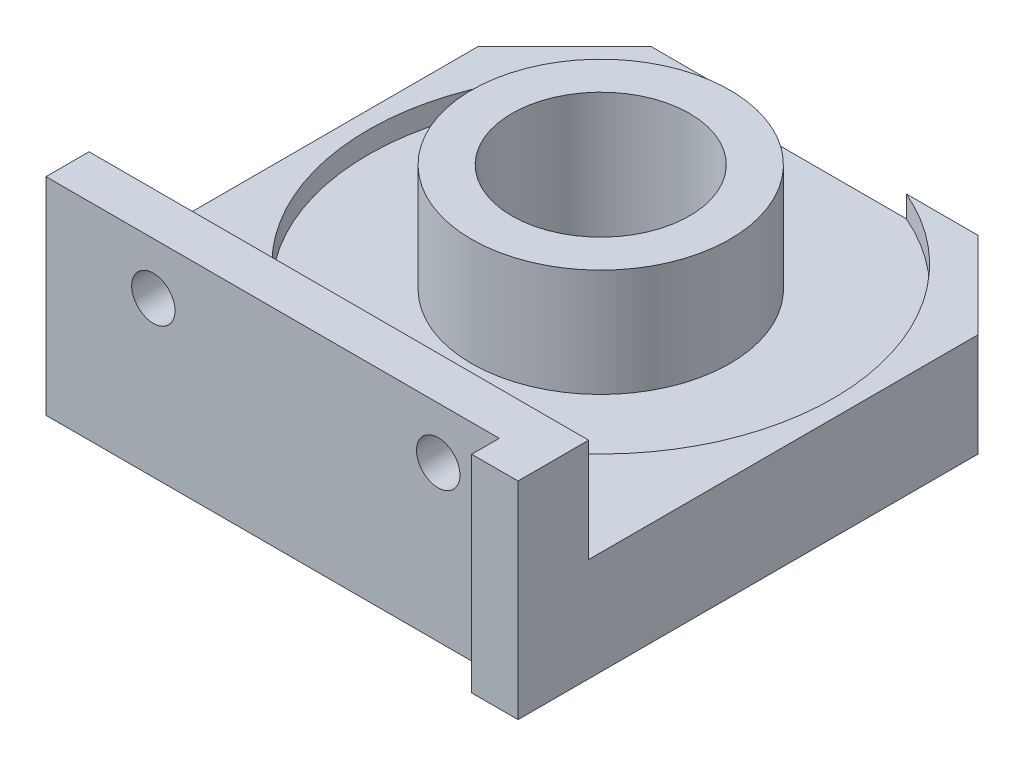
SolidWorks part; units mm, degrees
ref_plane "Front Plane" through (0, 0, 0) normal (0, 0, 1) x (1, 0, 0)
ref_plane "Top Plane" through (0, 0, 0) normal (0, 1, 0) x (1, 0, 0)
ref_plane "Right Plane" through (0, 0, 0) normal (1, 0, 0) x (0, 0, -1)
sketch "Sketch1" plane through (0, 0, 0) normal (0, 1, 0) x (1, 0, 0)
  line L1 (0, 0) -> (-36.83, 0)
  line L2 (0, 0) -> (0, 38.227)
  line L3 (0, 38.227) -> (-36.83, 38.227)
  line L4 (-36.83, 0) -> (-36.83, 38.227)
  dimension "D1" = 38.227
  dimension "D2" = 36.83
extrude "Boss-Extrude1" add sketch "Sketch1" against normal blind 7.62
sketch "Sketch2" plane through (0, 0, 0) normal (0, 1, 0) x (1, 0, 0)
  line L0 (-36.83, 38.227) -> (-36.83, 0) construction
  line L1 (0, 0) -> (-36.83, 0)
  line L2 (0, 0) -> (0, 3.175)
  line L3 (0, 3.175) -> (-36.83, 3.175)
  line L4 (-36.83, 0) -> (-36.83, 3.175)
  dimension "D1" = 3.175
extrude "Boss-Extrude2" add sketch "Sketch2" along normal blind 7.62
sketch "Sketch3" plane through (0, 0, 0) normal (0, 0, 1) x (1, 0, 0)
  line L0 (-36.83, -7.62) -> (0, -7.62) construction
  line L1 (0, 7.62) -> (-3.415, 7.62)
  line L2 (0, 7.62) -> (0, -7.62)
  line L3 (0, -7.62) -> (-3.415, -7.62)
  line L4 (-3.415, 7.62) -> (-3.415, -7.62)
  dimension "D1" = 3.415
extrude "Boss-Extrude3" add sketch "Sketch3" along normal blind 2.032
sketch "Sketch4" plane through (0, 0, 0) normal (0, 1, 0) x (1, 0, 0)
  line L0 (-36.83, 0) -> (-3.415, 0) construction
  line L1 (-36.83, 22.48) -> (0, 22.48) construction
  line L2 (-36.83, 38.227) -> (-36.83, 3.175) construction
  line L3 (0, 3.175) -> (0, 38.227) construction
  circle A0 centre (-18.415, 22.48) radius 9.525
  point P10 (-18.415, 22.48)
  dimension "D2" = 19.05
  dimension "D1" = 22.48
extrude "Boss-Extrude4" add sketch "Sketch4" along normal blind 6.35
hole_wizard "9/16-18 Tapped Hole1" positions "Sketch6" profile "Sketch5" tap size "9/16-18" standard "ANSI Inch"
sketch "Sketch6" plane through (0, 6.35, 0) normal (0, 1, 0) x (1, 0, 0)
  point P0 (-18.415, 22.48)
sketch "Sketch5" plane through (-18.415, 6.35, -22.48) normal (1, 0, 0) x (0, 0, 1)
  line L0 (0, 0) -> (0, 13.97)
  line L1 (0, 13.97) -> (6.5481, 13.97)
  line L2 (6.5481, 13.97) -> (6.5481, 0)
  line L5 (6.5481, 0) -> (0, 0)
  line L11 (0, -6.35) -> (0, 107.95) construction
  dimension "Thru Tap Drill Dia." = 13.0962
  dimension "Thru Tap Drill Depth" = 13.97
hole_wizard "M3 Clearance Hole1" positions "Sketch10" profile "Sketch9" hole size "M3" standard "ANSI Metric"
sketch "Sketch10" plane through (0, 0, -3.175) normal (0, 0, -1) x (-1, 0, 0)
  line L4 (18.415, 3.81) -> (7.915, 3.81) construction
  line L6 (18.415, 3.81) -> (28.915, 3.81) construction
  line L8 (0, -7.62) -> (36.83, -7.62) construction
  point P0 (28.915, 3.81)
  point P2 (7.915, 3.81)
  dimension "D1" = 21
  dimension "D2" = 11.43
sketch "Sketch9" plane through (-28.915, 3.81, -3.175) normal (1, 0, 0) x (0, 1, 0)
  line L0 (0, 0) -> (0, 3.175)
  line L1 (0, 3.175) -> (1.6, 3.175)
  line L2 (1.6, 3.175) -> (1.6, 0)
  line L5 (1.6, 0) -> (0, 0)
  line L11 (0, -6.35) -> (0, 107.95) construction
  dimension "Thru Hole Dia." = 3.2
  dimension "Thru Hole Depth" = 3.175
chamfer "Chamfer1" distance 6.35 angle 45 2 edges at (0, -3.81, -38.227) (-36.83, -3.81, -38.227)
sketch "Sketch11" plane through (0, 0, 0) normal (0, 1, 0) x (1, 0, 0)
  circle A0 centre (-18.415, 22.48) radius 17.145
  circle A1 centre (-18.415, 22.48) radius 9.525 construction
  circle A2 centre (-18.415, 22.48) radius 9.525
  dimension "D1" = 34.29
sketch "Sketch12" plane through (0, -7.62, 0) normal (0, -1, 0) x (1, 0, 0)
  circle A0 centre (-18.415, -22.48) radius 10.795
  dimension "D1" = 21.59
hole_wizard "M3x0.5 Tapped Hole1" positions "Sketch14" profile "Sketch13" tap size "M3x0.5" standard "ANSI Metric"
sketch "Sketch14" plane through (-36.83, 0, 0) normal (-1, 0, 0) x (0, 0, 1)
  line L0 (-31.877, -3.81) -> (-26.4795, -3.81) construction
  line L1 (-31.877, 0) -> (-31.877, -7.62) construction
  point P0 (-7.4295, -3.81)
  point P2 (-26.4795, -3.81)
  dimension "D1" = 19.05
  dimension "D2" = 5.3975
sketch "Sketch13" plane through (-36.83, -3.81, -7.4295) normal (0, 1, 0) x (0, 0, 1)
  line L0 (0, 0) -> (0, 7.5)
  line L1 (0, 7.5) -> (1.25, 7.5)
  line L2 (1.25, 7.5) -> (1.25, 0)
  line L5 (1.25, 0) -> (0, 0)
  line L10 (0, 7.5) -> (-1.25, 7.5) construction
  line L11 (0, -6.35) -> (0, 107.95) construction
  dimension "Tap Drill Dia." = 2.5
  dimension "Tap Drill Depth" = 7.5
  dimension "Drill Angle" = 180
extrude "Cut-Extrude1" cut sketch "Sketch11" against normal blind 1.5875
